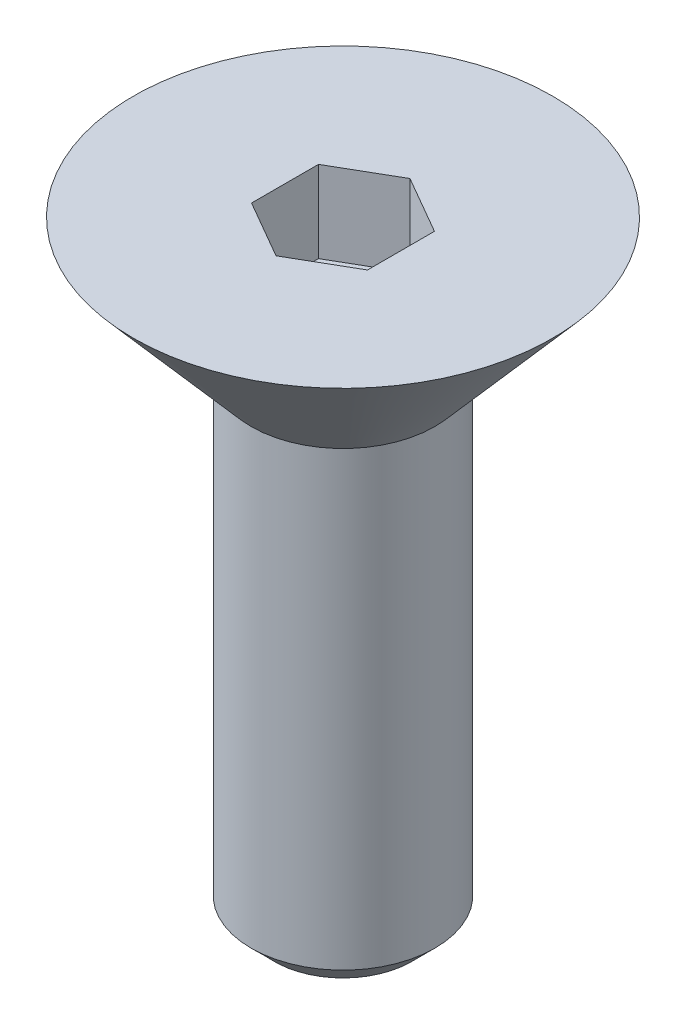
SolidWorks part; units mm, degrees
ref_plane "Plane1" through (0, 0, 0) normal (0, 0, 1) x (1, 0, 0)
ref_plane "Plane2" through (0, 0, 0) normal (0, 1, 0) x (1, 0, 0)
ref_plane "Plane3" through (0, 0, 0) normal (1, 0, 0) x (0, 0, -1)
sketch "Sketch1" plane through (0, 0, 0) normal (0, 0, 1) x (1, 0, 0)
  line L0 (0, 0) -> (1.2573, 0)
  line L1 (1.2573, 0) -> (2.8702, 1.8542)
  line L2 (2.8702, 1.8542) -> (0, 1.8542)
  line L3 (0, 1.8542) -> (0, 0)
  line L4 (0, 0) -> (0, 100) construction
revolve "Base-Revolve" add sketch "Sketch1" angle 360 about L4
sketch "Sketch2" plane through (0, 0, 0) normal (0, 0, 1) x (1, 0, 0)
  line L0 (0, 0) -> (0, 6.478) construction
  line L1 (0, -6.5) -> (0.9411, -6.5)
  line L2 (0.9411, -6.5) -> (1.2573, -6.1838)
  line L3 (1.2573, -6.1838) -> (1.2573, 0)
  line L4 (1.2573, 0) -> (0, 0)
  line L5 (0, 0) -> (0, -6.5)
  line L6 (-1.2573, 0) -> (1.2573, 0) construction
  dimension "D1" = 6.5
  dimension "D2" = 1.2573
  dimension "D3" = 0.3162
  dimension "D4" = 45
revolve "Boss-Revolve1" add sketch "Sketch2" angle 360 about L0
ref_plane "Plane4" through (0, 1.8542, 0) normal (0, 1, 0) x (-1, 0, 0)
sketch "Sketch3" plane through (0, 1.8542, 0) normal (0, 1, 0) x (-1, 0, 0)
  line L0 (0.7937, 0.4583) -> (0, 0.9165)
  line L1 (0, 0.9165) -> (-0.7938, 0.4583)
  line L2 (-0.7938, 0.4583) -> (-0.7937, -0.4583)
  line L3 (-0.7937, -0.4583) -> (0, -0.9165)
  line L4 (0, -0.9165) -> (0.7938, -0.4583)
  line L5 (0.7938, -0.4583) -> (0.7937, 0.4583)
extrude "Cut-Extrude1" cut sketch "Sketch3" against normal blind 1.1176
